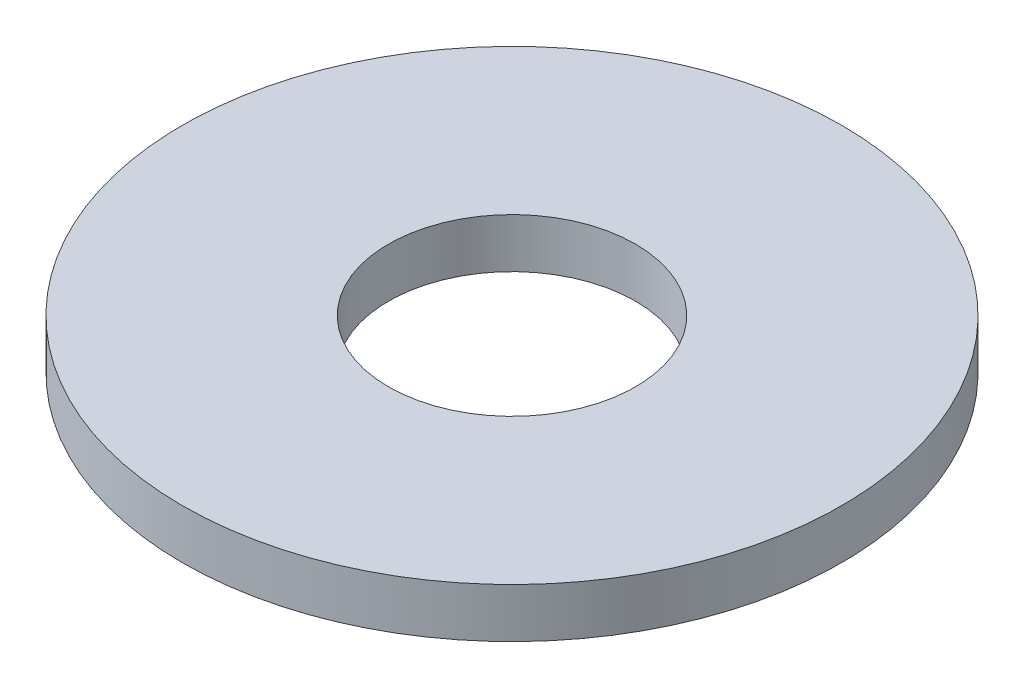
SolidWorks part; units mm, degrees
ref_plane "Front" through (0, 0, 0) normal (0, 0, 1) x (1, 0, 0)
ref_plane "Top" through (0, 0, 0) normal (0, 1, 0) x (1, 0, 0)
ref_plane "Right" through (0, 0, 0) normal (1, 0, 0) x (0, 0, -1)
sketch "Sketch1" plane through (0, 0, 0) normal (0, 1, 0) x (1, 0, 0)
  circle A0 centre (0, 0) radius 0.75
  circle A1 centre (0, 0) radius 2
extrude "Extrude1" add sketch "Sketch1" along normal blind 0.3
